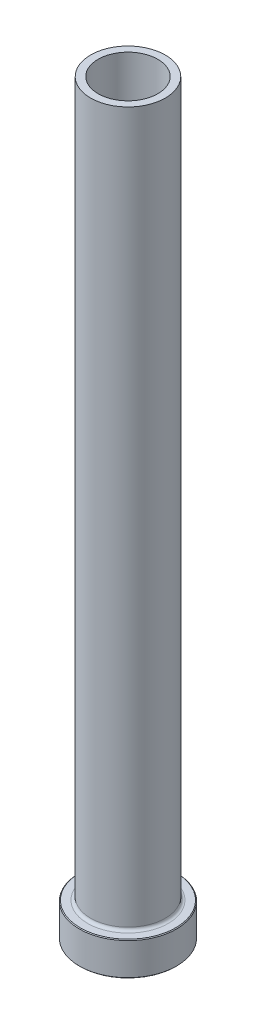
SolidWorks part; units mm, degrees
ref_plane "Front Plane" through (0, 0, 0) normal (0, 0, 1) x (1, 0, 0)
ref_plane "Top Plane" through (0, 0, 0) normal (0, 1, 0) x (1, 0, 0)
ref_plane "Right Plane" through (0, 0, 0) normal (1, 0, 0) x (0, 0, -1)
sketch "Sketch1" plane through (0, 0, 0) normal (0, 0, 1) x (1, 0, 0)
  line L0 (-8, 200) -> (-10, 200)
  line L1 (-10, 200) -> (-10, 9)
  line L2 (-10, 9) -> (-13, 9)
  line L3 (-13, 9) -> (-13, 0)
  line L4 (14.3, 0) -> (-14.3, 0) construction
  line L5 (-13, 0) -> (-8.25, 0)
  line L6 (-8, 145) -> (-8, 200)
  line L7 (0, 92.1877) -> (0, -15.5353) construction
  line L8 (0, -14.3) -> (0, 14.3) construction
  line L9 (-8, 145) -> (-8.25, 133)
  line L10 (-8.25, 133) -> (-8.25, 0)
  dimension "D1" = 0.25
  dimension "ID" = 16
  dimension "OD" = 20
  dimension "L" = 200
  dimension "H" = 26
  dimension "T" = 9
  dimension "N" = 55
  dimension "D2" = 12
revolve "Revolve1" add sketch "Sketch1" angle 360 about L7
fillet "Fillet1" radius 0.8 1 edges at (0, 9, 10)
chamfer "Chamfer1" distance 0.2 angle 45 2 edges at (0, 9, 13) (0, 0, 13)
chamfer "Chamfer3" distance 0.5 angle 45 1 edges at (0, 0, 8.25)
